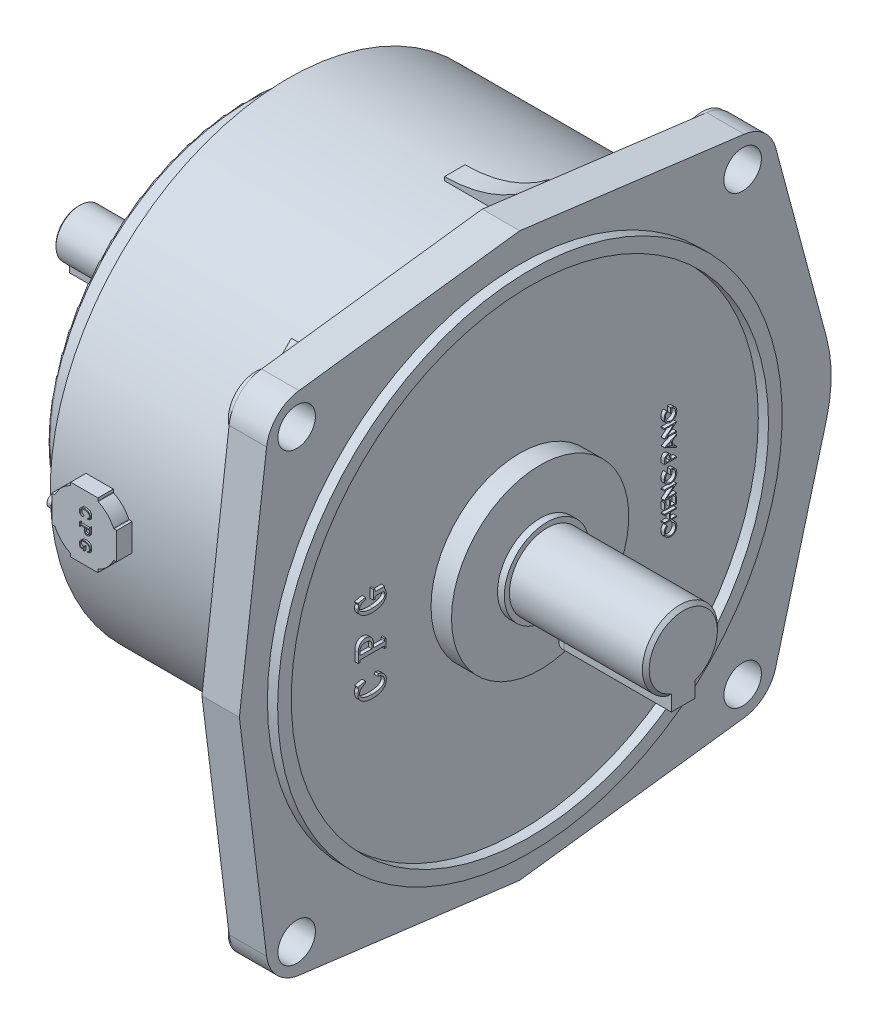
SolidWorks part; units mm, degrees
ref_plane "前视基准面" through (0, 0, 0) normal (0, 0, 1) x (1, 0, 0)
ref_plane "上视基准面" through (0, 0, 0) normal (0, 1, 0) x (1, 0, 0)
ref_plane "右视基准面" through (0, 0, 0) normal (1, 0, 0) x (0, 0, -1)
sketch "草图1" plane through (0, 0, 0) normal (0, 1, 0) x (1, 0, 0)
  line L0 (0, 0) -> (15.7361, 0) construction
  line L1 (0, 0) -> (0, -11)
  line L2 (0, -11) -> (-40, -11)
  line L3 (-40, -11) -> (-40, -12.5)
  line L4 (-40, -12.5) -> (-42, -12.5)
  line L5 (-45, -26) -> (-45, -74)
  line L6 (-45, -74) -> (-48, -74)
  line L7 (-48, -74) -> (-48, 0)
  line L8 (-48, 0) -> (0, 0)
  line L9 (-45, -26) -> (-42, -26)
  line L10 (-42, -26) -> (-42, -12.5)
  dimension "D1" = 40
  dimension "D2" = 22
  dimension "D3" = 25
  dimension "D4" = 3
  dimension "D5" = 148
  dimension "D6" = 48
  dimension "D7" = 3
  dimension "D8" = 52
revolve "旋转1" add sketch "草图1" angle 360 about L0
sketch "草图2" plane through (0, 0, 0) normal (0, 1, 0) x (1, 0, 0)
  line L0 (8.0167, 17.5) -> (-59, 17.5) construction
  line L1 (-48, 74) -> (-48, -74) construction
  line L4 (-59, 17.5) -> (-59, -52.25)
  line L5 (-59, -52.25) -> (-133.456, -52.25)
  line L6 (-133.456, -52.25) -> (-133.456, 17.5)
  line L11 (-59, 17.5) -> (-133.456, 17.5)
  dimension "D1" = 17.5
  dimension "D2" = 11
  dimension "D3" = 139.5
revolve "旋转2" add sketch "草图2" angle 360 about L0
sketch "草图12" plane through (-59, 0, 0) normal (1, 0, 0) x (0, 0, -1)
  line L0 (0, -82.5) -> (73.1856, -73.1856)
  line L1 (-73.1856, -73.1856) -> (0, -82.5)
  line L2 (-73.1856, -73.1856) -> (-82.2044, 0)
  line L3 (-73.1856, 73.1856) -> (0, 82.5)
  line L4 (73.1856, -73.1856) -> (92.7956, 0)
  line L5 (-82.2044, 0) -> (-73.1856, 73.1856)
  line L6 (0, 82.5) -> (73.1856, 73.1856)
  line L7 (92.7956, 0) -> (73.1856, 73.1856)
  line L8 (167.8979, 0) -> (-107.2143, 0) construction
  line L9 (0, 107.5085) -> (0, -103.3164) construction
  line L10 (0, 0) -> (-65.4074, 65.4074) construction
  line L11 (0, 0) -> (65.4074, 65.4074) construction
  circle A0 centre (0, 0) radius 92.5 construction
  circle A1 centre (-65.4074, 65.4074) radius 5.5
  circle A2 centre (65.4074, 65.4074) radius 5.5
  circle A3 centre (65.4074, -65.4074) radius 5.5
  circle A4 centre (-65.4074, -65.4074) radius 5.5
  dimension "D3" = 185
  dimension "D4" = 11
  dimension "D5" = 15
  dimension "D1" = 165
  dimension "D2" = 175
  dimension "D6" = 11
extrude "拉伸8" add sketch "草图12" along normal up to surface (11 mm away)
sketch "草图5" plane through (0, 0, 0) normal (0, 1, 0) x (1, 0, 0)
  line L0 (0, -3.5) -> (-31.5, -3.5)
  line L1 (0, -11) -> (0, 11) construction
  line L2 (-31.5, 3.5) -> (0, 3.5)
  line L3 (0, 3.5) -> (0, -3.5)
  line L4 (25, -13.7955) -> (25, 19.6443) construction
  arc A0 (-31.5, -3.5) -> (-31.5, 3.5) centre (-31.5, 0) cw
  dimension "D2" = 35
  dimension "D1" = 7
  dimension "D3" = 25
extrude "拉伸4" add sketch "草图5" against normal blind 14
fillet "圆角4" radius 11 4 edges at (-53.5, 73.1856, 73.1856) (-53.5, 73.1856, -73.1856) (-53.5, -73.1856, -73.1856) (-53.5, -73.1856, 73.1856)
fillet "圆角5" radius 40 1 edges at (-53.5, 0, -92.7956)
chamfer "倒角1" distance 1 angle 45 1 edges at (0, 11, 0)
sketch "草图18" plane through (-59, 0, 0) normal (-1, 0, 0) x (0, 0, 1)
  line L0 (-17.5, 0) -> (57.6613, -75.1613) construction
  line L1 (0, -73.4008) -> (0, 73.4008) construction
  line L2 (64.7028, -74.2652) -> (0, -82.5) construction
  line L3 (31.8207, -49.3207) -> (57.6613, -75.1613)
  line L4 (-17.5, 0) -> (-65.4074, -65.4074) construction
  line L5 (-64.4716, -63.2059) -> (-58.7151, -56.2705)
  line L7 (-17.5, 0) -> (-17.5, -80.2727) construction
  line L8 (0, -82.5) -> (-65.8603, -74.1178) construction
  line L9 (-17.5, -69.75) -> (-17.5, -80.2727)
  circle A0 centre (-17.5, 0) radius 69.75 construction
  arc A1 (-75.0967, -66.0529) -> (-65.8603, -74.1178) centre (-64.4716, -63.2059) ccw construction
  circle A3 centre (-17.5, 0) radius 69.75 construction
  dimension "D1" = 45
  dimension "D2" = 9.013
  dimension "D4" = 36.5442
  dimension "D5" = 10.5227
ref_plane "基准面7" through (-60, 0, 0) normal (1, 0, 0) x (0, 0, -1)
sketch "草图13" plane through (-59, 0, 0) normal (1, 0, 0) x (0, 0, -1)
  line L5 (0, 0) -> (107.7406, 0) construction
  circle A1 centre (65.4074, 65.4074) radius 8.6078
  circle A3 centre (65.4074, 65.4074) radius 5.5
  circle A4 centre (65.4074, -65.4074) radius 5.5 construction
  circle A5 centre (65.4074, -65.4074) radius 5.5
  circle A7 centre (-65.4074, -65.4074) radius 5.5
  arc A10 (65.8603, -74.1178) -> (75.0967, -66.0529) centre (64.4716, -63.2059) ccw construction
  circle A11 centre (-65.4074, -65.4074) radius 5.5 construction
  arc A12 (-74.2314, -64.6986) -> (-64.7028, -74.2652) centre (-63.314, -63.3532) ccw construction
  circle A14 centre (-65.4074, 65.4074) radius 5.5
  circle A15 centre (-65.4074, 65.4074) radius 8.0671
  circle A20 centre (-65.4074, -65.4074) radius 8.0671
  circle A21 centre (65.4074, -65.4074) radius 8.6078
  point P8 (17.5, 0)
extrude "拉伸9" add sketch "草图13" against normal up to surface (1 mm away)
sketch "草图14" plane through (0, 0, 0) normal (0, 1, 0) x (1, 0, 0)
  line L0 (-59, 17.5) -> (-133.456, 17.5) construction
  line L5 (-59, -64.7028) -> (-59, 0) construction
  line L6 (-84.5442, -52.25) -> (-84.5442, -53.25)
  line L7 (-59, -77.7942) -> (-60, -77.7942)
  line L9 (-59, -52.25) -> (-133.456, -52.25) construction
  arc A0 (-60, -77.7942) -> (-84.5442, -53.25) centre (-84.5442, -77.7942) ccw
  dimension "D1" = 95.2942
  dimension "D2" = 1
  dimension "D3" = 1
rib "筋17" sketch "草图14" sketch "草图14" thickness 6 extrusion direction parallel to sketch draft on no parameters "D1"=6
pattern_circular "阵列(圆周)16" count 8 over 360 about axis through (0, 0, -17.5) along (1, 0, 0) of "筋17"
ref_plane "基准面8" through (0, 0, -17.5) normal (0, 0, 1) x (1, 0, 0)
sketch "草图17" plane through (0, 0, -17.5) normal (0, 0, 1) x (1, 0, 0)
  line L0 (-59, -79.2727) -> (-60, -79.2727)
  line L1 (-59, -74.2652) -> (-59, -82.5) construction
  line L2 (-84.5442, -69.75) -> (-84.5442, -70.75)
  line L4 (-133.456, -69.75) -> (-59, -69.75) construction
  line L6 (-84.5442, -52.1491) -> (-84.5442, -47.9065) construction
  arc A0 (-60, -79.2727) -> (-84.5442, -70.75) centre (-84.5442, -110.3531) ccw
  dimension "D1" = 9.5227
  dimension "D2" = 1
  dimension "D3" = 1
rib "筋24" sketch "草图17" sketch "草图17" thickness 6 extrusion direction parallel to sketch draft on no parameters "D1"=6
mirror "镜向1" about plane through (0, 0, 0) normal (0, 1, 0) of "筋24"
sketch "草圖1" plane through (0, 0, 0) normal (0, 1, 0) x (1, 0, 0)
  line L0 (-171.5, 24.5) -> (-194.5, 24.5)
  line L1 (-194.5, 24.5) -> (-195, 24)
  line L2 (-195, 24) -> (-195, 17.5)
  line L3 (-168, 42.7) -> (-168, 24.75)
  line L4 (-170, 24.45) -> (-171.5, 24.45)
  line L5 (-170, 24.45) -> (-169.5, 24.75)
  line L6 (-169.5, 24.75) -> (-168, 24.75)
  line L7 (-133.956, 75.5) -> (-145.2, 75.5)
  line L8 (-159.3476, 43.5) -> (-167.2, 43.5)
  line L9 (-146.3797, 51.5851) -> (-158.7273, 43.7156)
  line L10 (-179.3544, 17.5) -> (-77.5909, 17.5) construction
  line L11 (-133.456, 75) -> (-133.456, 17.5)
  line L12 (-133.456, 87.25) -> (-133.456, -52.25) construction
  line L13 (-195, 17.5) -> (-133.456, 17.5)
  line L14 (-146, 74.7) -> (-146, 52.3695)
  line L15 (-171.5, 24.5) -> (-171.5, 24.45)
  line L16 (-133.456, 87.25) -> (-133.456, -52.25)
  arc A0 (-167.2, 43.5) -> (-168, 42.7) centre (-167.2, 42.7) ccw
  arc A3 (-159.3476, 43.5) -> (-158.7273, 43.7156) centre (-159.3476, 44.5) ccw
  arc A6 (-146.3797, 51.5851) -> (-146, 52.3695) centre (-147, 52.3695) ccw
  arc A7 (-145.2, 75.5) -> (-146, 74.7) centre (-145.2, 74.7) ccw
  arc A8 (-133.456, 75) -> (-133.956, 75.5) centre (-133.956, 75) ccw
  dimension "D1" = 17.5
  dimension "D2" = 116
  dimension "D3" = 14
  dimension "D4" = 25
  dimension "D5" = 195
revolve "旋轉2" add sketch "草圖1" angle 360 about L10
ref_plane "平面1" through (0, 0, -17.5) normal (0, 0, 1) x (1, 0, 0)
sketch "草圖4" plane through (-45, 0, 0) normal (1, 0, 0) x (0, 0, -1)
  circle A0 centre (0, 0) radius 70
  circle A1 centre (0, 0) radius 26 construction
  circle A2 centre (0, 0) radius 26
  dimension "D1" = 140
extrude "伸長2" cut sketch "草圖4" against normal blind 3
sketch "草圖5"
  dimension "D1" = 40
  dimension "D2" = 45
  dimension "D3" = 60
  dimension "D4" = 60
  dimension "D5" = 30
extrude "伸長3" add sketch "草圖5" along normal blind 1
sketch "草圖6" plane through (0, 0, 0) normal (0, 1, 0) x (1, 0, 0)
  line L0 (-214.7332, 17.5) -> (-161.1739, 17.5) construction
  line L1 (-195, 15) -> (-175.5, 15)
  line L2 (-195, 24) -> (-195, 11) construction
  line L3 (-175.5, 20) -> (-195, 20)
  line L4 (-195, 20) -> (-195, 15)
  line L5 (-173, 17.5) -> (-173, 3.9275) construction
  line L6 (-211.2, 17.5) -> (-211.2, 2.6338) construction
  arc A0 (-175.5, 15) -> (-175.5, 20) centre (-175.5, 17.5) ccw
  dimension "D1" = 7
  dimension "D2" = 5
  dimension "D3" = 2.5
  dimension "D4" = 22
  dimension "D5" = 16.2
extrude "伸長4" add sketch "草圖6" against normal blind 9.2
ref_plane "平面2" through (0, 0, 56.7) normal (0, 0, 1) x (1, 0, 0)
sketch "草圖7" plane through (0, 0, 56.7) normal (0, 0, 1) x (1, 0, 0)
  line L0 (-123, 9.5) -> (-115, 9.5)
  line L2 (-123, 8.7121) -> (-123, 9.5)
  line L3 (-115, 8.7121) -> (-115, 9.5)
  line L4 (-127.7121, 4) -> (-128.5, 4)
  line L5 (-127.7121, -4) -> (-128.5, -4)
  line L6 (-128.5, -4) -> (-128.5, 4)
  line L7 (-123, -8.7121) -> (-123, -9.5)
  line L8 (-115, -8.7121) -> (-115, -9.5)
  line L9 (-115, -9.5) -> (-123, -9.5)
  line L10 (-110.2879, -4) -> (-109.5, -4)
  line L11 (-110.2879, 4) -> (-109.5, 4)
  line L12 (-109.5, 4) -> (-109.5, -4)
  arc A0 (-123.0855, 8.5766) -> (-127.5766, 4.0855) centre (-119, 0) ccw
  arc A1 (-123.0855, 8.5766) -> (-123, 8.7121) centre (-123.15, 8.7121) ccw
  arc A2 (-115, 8.7121) -> (-114.9145, 8.5766) centre (-114.85, 8.7121) ccw
  arc A3 (-127.7121, 4) -> (-127.5766, 4.0855) centre (-127.7121, 4.15) ccw
  arc A4 (-127.5766, -4.0855) -> (-127.7121, -4) centre (-127.7121, -4.15) ccw
  arc A5 (-123, -8.7121) -> (-123.0855, -8.5766) centre (-123.15, -8.7121) ccw
  arc A6 (-114.9145, -8.5766) -> (-115, -8.7121) centre (-114.85, -8.7121) ccw
  arc A7 (-110.2879, -4) -> (-110.4234, -4.0855) centre (-110.2879, -4.15) ccw
  arc A8 (-110.4234, 4.0855) -> (-110.2879, 4) centre (-110.2879, 4.15) ccw
  arc A9 (-127.5766, -4.0855) -> (-123.0855, -8.5766) centre (-119, 0) ccw
  arc A10 (-114.9145, -8.5766) -> (-110.4234, -4.0855) centre (-119, 0) ccw
  arc A11 (-110.4234, 4.0855) -> (-114.9145, 8.5766) centre (-119, 0) ccw
extrude "伸長5" add sketch "草圖7" against normal blind 4.5
sketch "草圖8"
extrude "伸長6" add sketch "草圖8" along normal blind 0.5
sketch "草圖9" plane through (0, 0, 0) normal (0, 1, 0) x (1, 0, 0)
  line L0 (-127.7177, -53.4307) -> (-124.0482, -53.6345)
  line L1 (-129.3486, -53.4307) -> (-127.7177, -53.4307)
  line L2 (-129.3486, -53.4307) -> (-129.3486, -52.8191)
  line L3 (-130.5718, -52.8191) -> (-129.3486, -52.8191)
  line L4 (-124.0482, -54.45) -> (-124.0482, -53.6345)
  line L5 (-124.0482, -54.45) -> (-130.5718, -54.45)
  line L6 (-130.5718, -52.8191) -> (-130.5718, -54.45)
revolve "旋轉3" add sketch "草圖9" angle 360 about L5
equation "\"D3@草图1\" = \"D2@草图1\"+3"
equation "\"D1@拉伸4\" = \"D3@草图5\"-\"D2@草图1\"/2"
equation "\"D5@草图1\" = \"D1@草圖4\"+8"
equation "\"D1@伸長4\" = \"D5@草圖6\"-\"D3@草圖1\"/2"
